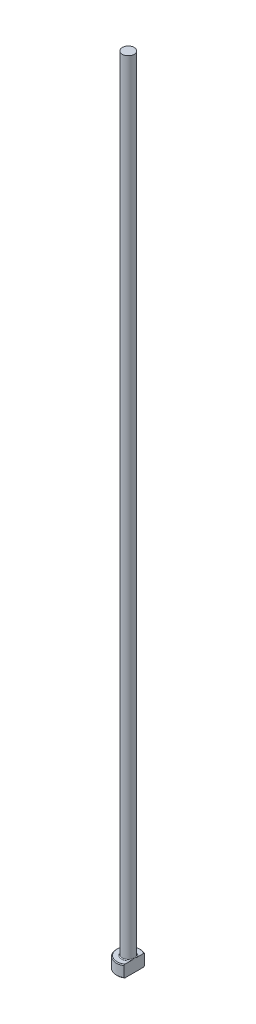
SolidWorks part; units mm, degrees
ref_plane "Front Plane" through (0, 0, 0) normal (0, 0, 1) x (1, 0, 0)
ref_plane "Top Plane" through (0, 0, 0) normal (0, 1, 0) x (1, 0, 0)
ref_plane "Right Plane" through (0, 0, 0) normal (1, 0, 0) x (0, 0, -1)
sketch "Sketch1" plane through (0, 0, 0) normal (0, 0, 1) x (1, 0, 0)
  line L0 (0, 259.9588) -> (0, -15.1925) construction
  line L1 (0, 0) -> (-3, 0)
  line L2 (-3, 0) -> (-3, 3)
  line L3 (-3, 3) -> (-1.5, 3)
  line L4 (-1.5, 3) -> (-1.5, 200)
  line L5 (-1.5, 200) -> (0, 200)
  line L6 (0, 200) -> (0, 0)
  dimension "L" = 200
  dimension "H" = 6
  dimension "T" = 3
  dimension "D" = 3
revolve "Revolve1" add sketch "Sketch1" angle 360 about L0
chamfer "Chamfer1" distance 0.2 angle 45 2 edges at (0, 3, 3) (0, 0, 3)
fillet "Fillet1" radius 0.2 1 edges at (0, 3, 1.5)
sketch "Sketch2" plane through (0, 0, 0) normal (0, 1, 0) x (1, 0, 0)
  line L0 (1.5, 2.5981) -> (1.5, -2.5981)
  circle A0 centre (0, 0) radius 3 construction
  arc A1 (1.5, -2.5981) -> (1.5, 2.5981) centre (0, 0) ccw
  circle A2 centre (0, 0) radius 1.5 construction
extrude "KEY" cut sketch "Sketch2" along normal through all
